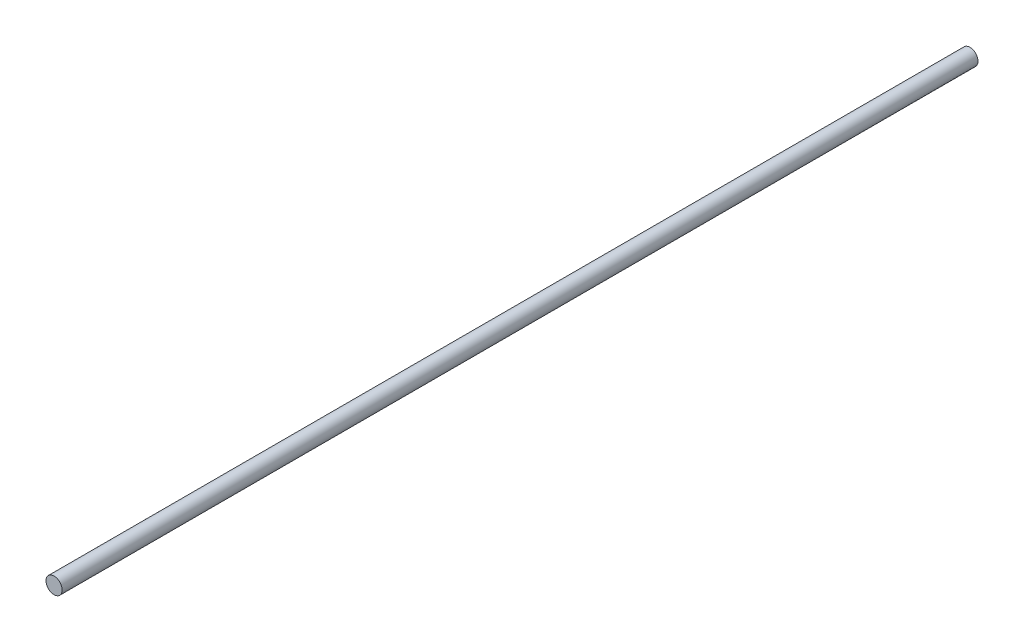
SolidWorks part; units mm, degrees
ref_plane "Front Plane" through (0, 0, 0) normal (0, 0, 1) x (1, 0, 0)
ref_plane "Top Plane" through (0, 0, 0) normal (0, 1, 0) x (1, 0, 0)
ref_plane "Right Plane" through (0, 0, 0) normal (1, 0, 0) x (0, 0, -1)
sketch "Sketch1" plane through (0, 0, 0) normal (0, 0, 1) x (1, 0, 0)
  circle A0 centre (0, 0) radius 30
  dimension "D1" = 60
extrude "Boss-Extrude1" add sketch "Sketch1" against normal blind 3400
